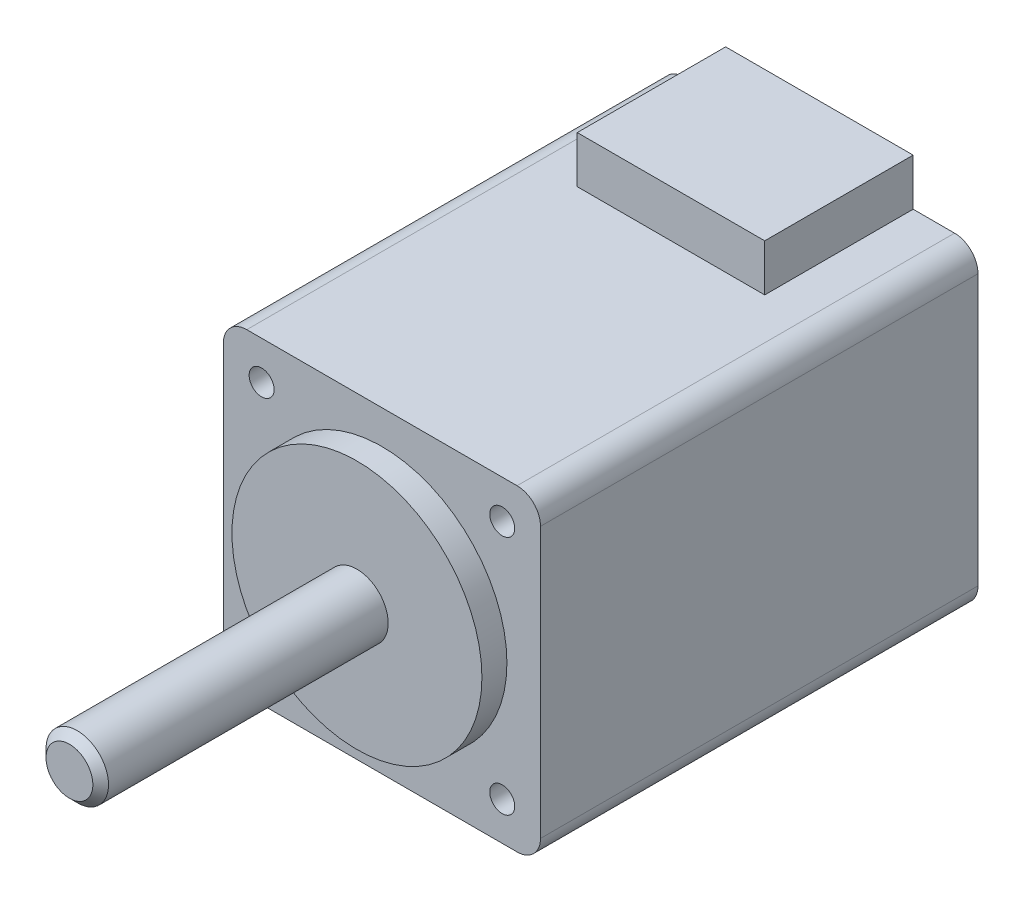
SolidWorks part; units mm, degrees
ref_plane "前视基准面" through (0, 0, 0) normal (0, 0, 1) x (1, 0, 0)
ref_plane "上视基准面" through (0, 0, 0) normal (0, 1, 0) x (1, 0, 0)
ref_plane "右视基准面" through (0, 0, 0) normal (1, 0, 0) x (0, 0, -1)
sketch "草图1" plane through (0, 0, 0) normal (0, 0, 1) x (1, 0, 0)
  circle A0 centre (0, 0) radius 8
extrude "凸台-拉伸1" add sketch "草图1" against normal blind 1.6
sketch "草图2" plane through (0, 0, 0) normal (0, 0, 1) x (1, 0, 0)
  circle A0 centre (0, 0) radius 2
extrude "凸台-拉伸2" add sketch "草图2" along normal blind 18.4
chamfer "倒角1" distance 0.5 angle 45 1 edges at (2, 0, 18.4)
sketch "草图4" plane through (0, 0, -1.6) normal (0, 0, -1) x (-1, 0, 0)
  line L1 (0, 10.15) -> (8.65, 10.15)
  line L2 (10.15, 8.65) -> (10.15, -8.65)
  line L3 (8.65, -10.15) -> (-8.65, -10.15)
  line L4 (-10.15, -8.65) -> (-10.15, 8.65)
  line L5 (-8.65, 10.15) -> (0, 10.15)
  arc A0 (-8.65, -10.15) -> (-10.15, -8.65) centre (-8.65, -8.65) cw
  arc A1 (10.15, -8.65) -> (8.65, -10.15) centre (8.65, -8.65) cw
  arc A2 (8.65, 10.15) -> (10.15, 8.65) centre (8.65, 8.65) cw
  arc A3 (-10.15, 8.65) -> (-8.65, 10.15) centre (-8.65, 8.65) cw
  dimension "D1" = 1.5
extrude "凸台-拉伸3" add sketch "草图4" along normal blind 28
sketch "草图6" plane through (0, 0, -29.6) normal (0, 0, -1) x (-1, 0, 0)
  line L0 (0, 10.15) -> (6, 10.15)
  line L1 (8.65, 10.15) -> (-8.65, 10.15) construction
  line L2 (6, 10.15) -> (6, 13.15)
  line L3 (6, 13.15) -> (-6, 13.15)
  line L4 (-6, 13.15) -> (-6, 10.15)
  line L5 (-6, 10.15) -> (0, 10.15)
extrude "凸台-拉伸4" add sketch "草图6" against normal blind 9.5
sketch "草图7" plane through (0, 0, -1.6) normal (0, 0, 1) x (1, 0, 0)
  point P8 (-7.7, 7.7)
  point P9 (7.7, 7.7)
  point P10 (7.7, -7.7)
  point P11 (-7.7, -7.7)
hole_wizard "M2 螺纹孔1" positions "草图9" profile "草图8" tap size "M2" standard "GB"
sketch "草图9" plane through (0, 0, -1.6) normal (0, 0, 1) x (1, 0, 0)
  point P0 (-7.7, 7.7)
  point P3 (7.7, 7.7)
  point P6 (7.7, -7.7)
  point P9 (-7.7, -7.7)
sketch "草图8" plane through (-7.7, 7.7, -1.6) normal (1, 0, 0) x (0, -1, 0)
  line L0 (0, 0) -> (0, 5.9807)
  line L1 (0, 5.9807) -> (0.8, 5.5)
  line L2 (0.8, 5.5) -> (0.8, 0)
  line L5 (0.8, 0) -> (0, 0)
  line L10 (0, 5.9807) -> (-0.8, 5.5) construction
  line L11 (0, -6.35) -> (0, 107.95) construction
  dimension "螺纹孔钻头直径" = 1.6
  dimension "螺纹孔钻头深度" = 5.5
  dimension "导头角度" = 118
